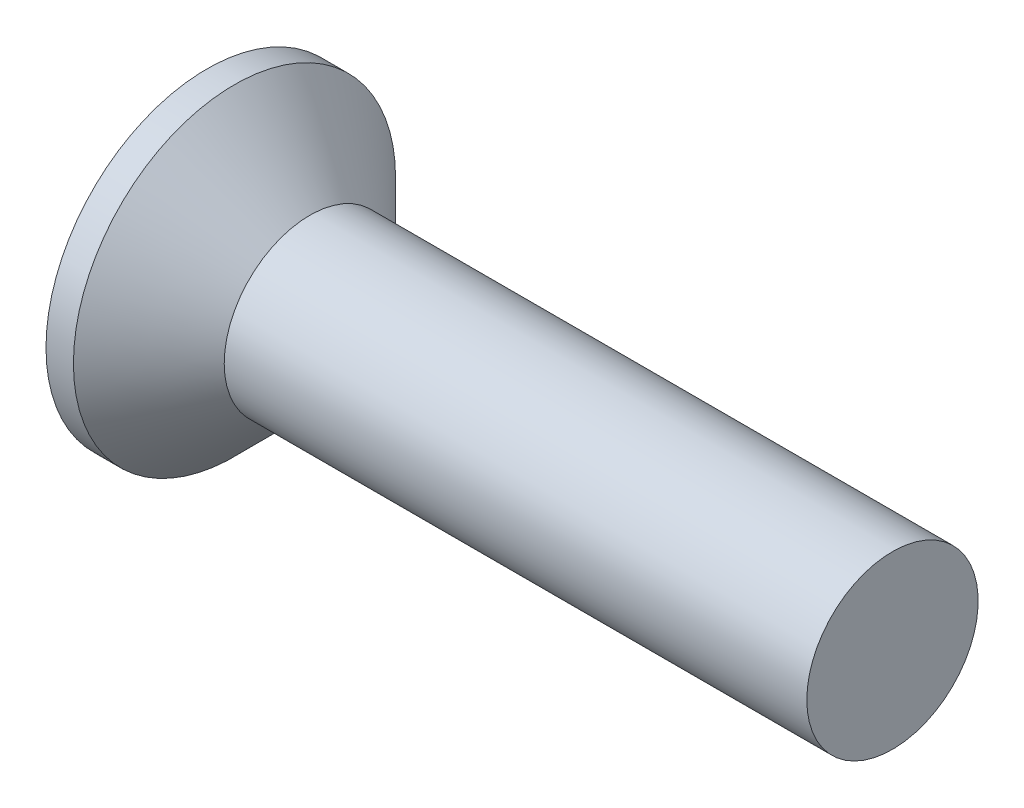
SolidWorks part; units mm, degrees
ref_plane "Plane1" through (0, 0, 0) normal (0, 0, 1) x (1, 0, 0)
ref_plane "Plane2" through (0, 0, 0) normal (0, 1, 0) x (1, 0, 0)
ref_plane "Plane3" through (0, 0, 0) normal (1, 0, 0) x (0, 0, -1)
sketch "BodySke" plane through (0, 0, 0) normal (0, 0, 1) x (1, 0, 0)
  line L0 (0, 0) -> (0, 2.35)
  line L1 (0, 2.35) -> (0.4, 2.35)
  line L2 (1.5, 1.25) -> (10, 1.25)
  line L3 (10, 1.25) -> (10, 0)
  line L4 (10, 0) -> (0, 0)
  line L5 (-6.35, 0) -> (82.55, 0) construction
  line L6 (1.5, -1.25) -> (10, -1.25) construction
  line L7 (0.4, -2.35) -> (1.5, -1.25) construction
  line L8 (0.4, 2.35) -> (1.5, 1.25)
  line L9 (0, -2.35) -> (0.4, -2.35) construction
  line L10 (1.95, 2.8375) -> (1.95, -6.6875) construction
  line L11 (0, 6.35) -> (0, -3.175) construction
  dimension "Diameter" = 2.5
  dimension "Length" = 10
  dimension "Head_ht" = 1.5
  dimension "Head_dia" = 4.7
  dimension "Head_ang" = 90
  dimension "D6" = 0.4
  dimension "Advance" = 0.45
  dimension "Thread_nom" = 10
revolve "Base-Revolve" add sketch "BodySke" angle 360 about L5
sketch "Sketch2" plane through (0, 0, 0) normal (-1, 0, 0) x (0, 0, 1)
  line L0 (-2.35, -0.4) -> (2.35, -0.4)
  line L1 (-2.35, -0.4) -> (-2.35, 0.4)
  line L2 (2.35, 0.4) -> (-2.35, 0.4)
  line L3 (2.35, 0.4) -> (2.35, -0.4)
  dimension "D1" = 0.4
  dimension "Slot_width" = 0.8
  dimension "D2" = 4.7
  dimension "D3" = 2.35
extrude "Slot" [suppressed] cut sketch "Sketch2" against normal blind 0.7
sketch "Sketch3" plane through (0, 0, 0) normal (-1, 0, 0) x (0, 0, 1)
  line L0 (-0.37, 1.4) -> (0.37, 1.4)
  line L1 (0.37, 1.4) -> (0.37, -1.4)
  line L2 (0.37, -1.4) -> (-0.37, -1.4)
  line L3 (-0.37, -1.4) -> (-0.37, 1.4)
  dimension "D1" = 1.4
  dimension "Cross_dia" = 2.8
  dimension "D2" = 0.37
  dimension "Cross_width" = 0.74
ref_plane "Plane4" through (1.78, 0, 0) normal (-1, 0, 0) x (0, 0, 1)
sketch "Sketch4" plane through (1.78, 0, 0) normal (-1, 0, 0) x (0, 0, 1)
  line L0 (-0.185, 0.185) -> (0.185, 0.185)
  line L3 (0.185, 0.185) -> (0.185, -0.185)
  line L4 (0.185, -0.185) -> (-0.185, -0.185)
  line L5 (-0.185, -0.185) -> (-0.185, 0.185)
  dimension "D1" = 0.37
  dimension "D2" = 0.37
  dimension "D3" = 0.185
  dimension "D4" = 0.185
loft "Cross" cut profiles "Sketch3", "Sketch4"
pattern_circular "CirPattern1" count 2 every 90 about axis through (0, 0, 0) along (1, 0, 0) of "Cross"
sketch "ThdSchSke" plane through (0, 0, 0) normal (0, 0, 1) x (1, 0, 0)
  line L0 (1.95, -0.9965) -> (1.7725, -1.25)
  line L1 (1.95, -0.9965) -> (2.1275, -1.25)
  line L2 (2.1275, -1.25) -> (2.1275, -1.5625)
  line L3 (-3.175, 0) -> (5.1513, 0) construction
  line L5 (2.1275, -1.5625) -> (1.7725, -1.5625)
  line L6 (1.7725, -1.5625) -> (1.7725, -1.25)
  line L7 (0, 2.35) -> (0, -2.35) construction
  dimension "Thread_minor" = 1.993
  dimension "Diameter" = 2.5
  dimension "Start" = 1.95
  dimension "SideAngle" = 55
  dimension "VeeAngle" = 70
  dimension "Overcut" = 3.125
revolve "ThreadSchematic" [suppressed] cut sketch "ThdSchSke" angle 360 about L3
pattern_linear "ThdSchPat" [suppressed]
equation "\"D1@Sketch3\" = \"Cross_dia@Sketch3\" / 2"
equation "\"D2@Sketch3\" = \"Cross_width@Sketch3\" / 2"
equation "\"D1@Sketch4\" = \"Cross_width@Sketch3\" *.5"
equation "\"D2@Sketch4\" = \"D1@Sketch4\""
equation "\"D4@Sketch4\" = \"D2@Sketch4\" / 2"
equation "\"D3@Sketch4\" = \"D1@Sketch4\" / 2"
equation "\"D1@Sketch2\" = \"Slot_width@Sketch2\" / 2"
equation "\"D2@Sketch2\" = \"Head_dia@BodySke\""
equation "\"D3@Sketch2\" = \"D2@Sketch2\" / 2"
equation "\"Thread_length@ThreadCosmetic\" = ((sgn( (\"Length@BodySke\" - \"Advance@BodySke\" - \"Head_ht@BodySke\" ) - \"Thread_nom@BodySke\" )-1)*( (\"Length@BodySke\" - \"Advance@BodySke\" - \"Head_ht@BodySke\" ) - \"Thread_"
equation "\"Thread_minor@ThdSchSke\" = \"Thread_minor@ThreadCosmetic\""
equation "\"Diameter@ThdSchSke\" = \"Diameter@BodySke\""
equation "\"Overcut@ThdSchSke\" = \"Diameter@BodySke\" * 1.25"
equation "\"Start@ThdSchSke\" = 0.000001 + \"Length@BodySke\" - \"Thread_length@ThreadCosmetic\"  '---Countersunk---"
equation "\"Num_threads@ThdSchPat\" = int( \"Thread_length@ThreadCosmetic\" / \"Advance@BodySke\" + 0.999 )  + 1"
equation "\"Advance@ThdSchPat\" = \"Thread_length@ThreadCosmetic\" /  (\"Num_threads@ThdSchPat\" - 1) 'relax it"
